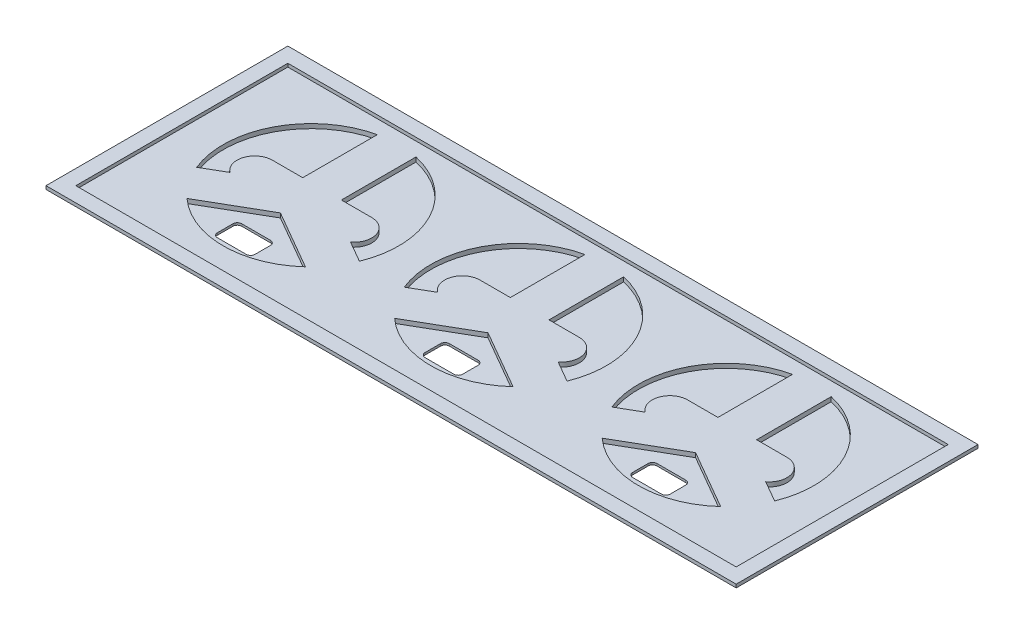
SolidWorks part; units mm, degrees
ref_plane "Front Plane" through (0, 0, 0) normal (0, 0, 1) x (1, 0, 0)
ref_plane "Top Plane" through (0, 0, 0) normal (0, 1, 0) x (1, 0, 0)
ref_plane "Right Plane" through (0, 0, 0) normal (1, 0, 0) x (0, 0, -1)
sketch "Sketch1" plane through (0, 0, 0) normal (0, 1, 0) x (1, 0, 0)
  line L1 (-151.5, 50) -> (151.5, 50)
  line L2 (-151.5, 50) -> (-151.5, -50)
  line L3 (-151.5, -50) -> (151.5, -50)
  line L4 (151.5, 50) -> (151.5, -50)
  line L5 (-151.5, 50) -> (151.5, -50) construction
  line L6 (-151.5, -50) -> (151.5, 50) construction
  point P0 (0, 0)
  dimension "D1" = 100
  dimension "D2" = 303
extrude "Boss-Extrude1" add sketch "Sketch1" along normal blind 3
sketch "Sketch2" plane through (0, 3, 0) normal (0, 1, 0) x (1, 0, 0)
  line L13 (-151.5, -50) -> (151.5, -50) construction
  line L14 (151.5, -50) -> (151.5, 50) construction
  line L15 (-151.5, 50) -> (-151.5, -50) construction
  line L16 (151.5, 50) -> (-151.5, 50) construction
  line L17 (-149.5, 48) -> (-149.5, -48)
  line L18 (-149.5, -48) -> (149.5, -48)
  line L19 (149.5, 48) -> (-149.5, 48)
  line L20 (149.5, -48) -> (149.5, 48)
  line L21 (-149.5, 48) -> (-149.5, -48)
  line L22 (-149.5, -48) -> (149.5, -48)
  line L23 (149.5, 48) -> (-149.5, 48)
  line L24 (149.5, -48) -> (149.5, 48)
  line L25 (-151.5, -50) -> (151.5, -50)
  line L26 (151.5, -50) -> (151.5, 50)
  line L27 (-151.5, 50) -> (-151.5, -50)
  line L28 (151.5, 50) -> (-151.5, 50)
  dimension "D1" = 2
extrude "Boss-Extrude3" add sketch "Sketch2" along normal blind 1.5 contours L24 L22 L21 L23 M12 M9 M10 M11
sketch "Sketch3" plane through (151.5, 0, 0) normal (1, 0, 0) x (0, 0, -1)
  line L0 (50, 4.5) -> (50, 0) construction
  line L1 (-50, 4.5) -> (50, 4.5)
  line L2 (-50, 4.5) -> (-50, 3)
  line L3 (-50, 3) -> (50, 3)
  line L4 (50, 4.5) -> (50, 3)
  dimension "D1" = 1.5
extrude "Boss-Extrude4" add sketch "Sketch3" along normal blind 4.75
sketch "Sketch5" plane through (0, 3, 0) normal (0, 1, 0) x (1, 0, 0)
  line L0 (149.5, -48) -> (149.5, 48) construction
  line L1 (0, 3) -> (0, 65.2785) construction
  line L2 (26.8157, -26.3425) -> (0, -10.8605)
  line L3 (-8.75, 41.775) -> (-8.75, 4.295)
  line L4 (8.75, 41.775) -> (8.75, 4.295)
  line L5 (36.8421, -11.924) -> (8.75, 4.295)
  line L6 (-36.8421, -11.924) -> (-8.75, 4.295)
  line L7 (-26.8157, -26.3425) -> (0, -10.8605)
  line L9 (-47, 60.0397) -> (-47, -70.5831) construction
  line L10 (5.6339, -4.0096) -> (33.9368, -20.3502) construction
  line L11 (-6.1109, -4.285) -> (-42.2034, -25.1229) construction
  line L12 (102.75, 41.775) -> (102.75, 4.295)
  line L13 (85.25, 41.775) -> (85.25, 4.295)
  line L14 (57.1579, -11.924) -> (85.25, 4.295)
  line L15 (67.1843, -26.3425) -> (94, -10.8605)
  line L16 (47, 76.7498) -> (47, -70.5831) construction
  line L17 (120.8157, -26.3425) -> (94, -10.8605)
  line L18 (130.8421, -11.924) -> (102.75, 4.295)
  line L19 (-67.1843, -26.3425) -> (-94, -10.8605)
  line L20 (-120.8157, -26.3425) -> (-94, -10.8605)
  line L21 (-130.8421, -11.924) -> (-102.75, 4.295)
  line L22 (-102.75, 41.775) -> (-102.75, 4.295)
  line L23 (-85.25, 41.775) -> (-85.25, 4.295)
  line L24 (-57.1579, -11.924) -> (-85.25, 4.295)
  line L26 (149.5, 48) -> (-149.5, 48) construction
  circle A3 centre (0, 3) radius 39.75
  arc A6 (26.8157, -26.3425) -> (-26.8157, -26.3425) centre (0, 3) cw
  arc A7 (36.8421, -11.924) -> (8.75, 41.775) centre (0, 3) ccw
  arc A8 (-8.75, 41.775) -> (-36.8421, -11.924) centre (0, 3) ccw
  circle A9 centre (94, 3) radius 39.75
  circle A10 centre (-94, 3) radius 39.75
  point P47 (0, 0)
  point P48 (0, 0)
  point P49 (0, 0)
  dimension "D1" = 79.5
  dimension "D2" = 37.48
  dimension "D3" = 17.5
  dimension "D4" = 17.5
  dimension "D9" = 14.5
  dimension "D10" = 14.5
  dimension "D11" = 5.25
  dimension "D5" = 17.5
  dimension "D6" = 120
  dimension "D7" = 8.75
  dimension "D8" = 8.75
  dimension "D12" = 3
extrude "Cut-Extrude2" cut sketch "Sketch5" against normal blind 2 contours A10 L23 L24 | A10 L21 L22 | A10 L19 L20 | L3 A3 L6 | L7 A3 L2 | L5 A3 L4 | A9 L12 L18 | A9 L17 L15 | A9 L14 L13
sketch "Sketch6" plane through (0, 1, 0) normal (0, 1, 0) x (1, 0, 0)
  line L1 (-6.5, -21.8605) -> (6.5, -21.8605)
  line L2 (-8.5, -23.8605) -> (-8.5, -30.8605)
  line L3 (-6.5, -32.8605) -> (6.5, -32.8605)
  line L4 (8.5, -23.8605) -> (8.5, -30.8605)
  line L5 (-8.5, -21.8605) -> (8.5, -32.8605) construction
  line L6 (-8.5, -32.8605) -> (8.5, -21.8605) construction
  line L7 (-100.5, -21.8605) -> (-87.5, -21.8605)
  line L8 (-102.5, -23.8605) -> (-102.5, -30.8605)
  line L9 (-100.5, -32.8605) -> (-87.5, -32.8605)
  line L10 (-85.5, -23.8605) -> (-85.5, -30.8605)
  line L11 (-102.5, -21.8605) -> (-85.5, -32.8605) construction
  line L12 (-102.5, -32.8605) -> (-85.5, -21.8605) construction
  line L13 (87.5, -21.8605) -> (100.5, -21.8605)
  line L14 (85.5, -23.8605) -> (85.5, -30.8605)
  line L15 (87.5, -32.8605) -> (100.5, -32.8605)
  line L16 (102.5, -23.8605) -> (102.5, -30.8605)
  line L17 (85.5, -21.8605) -> (102.5, -32.8605) construction
  line L18 (85.5, -32.8605) -> (102.5, -21.8605) construction
  arc A0 (-6.5, -21.8605) -> (-8.5, -23.8605) centre (-6.5, -23.8605) ccw
  arc A1 (-8.5, -30.8605) -> (-6.5, -32.8605) centre (-6.5, -30.8605) ccw
  arc A2 (6.5, -32.8605) -> (8.5, -30.8605) centre (6.5, -30.8605) ccw
  arc A3 (6.5, -21.8605) -> (8.5, -23.8605) centre (6.5, -23.8605) cw
  arc A5 (-87.5, -32.8605) -> (-85.5, -30.8605) centre (-87.5, -30.8605) ccw
  arc A6 (-102.5, -30.8605) -> (-100.5, -32.8605) centre (-100.5, -30.8605) ccw
  arc A7 (-100.5, -21.8605) -> (-102.5, -23.8605) centre (-100.5, -23.8605) ccw
  arc A8 (-87.5, -21.8605) -> (-85.5, -23.8605) centre (-87.5, -23.8605) cw
  arc A9 (85.5, -30.8605) -> (87.5, -32.8605) centre (87.5, -30.8605) ccw
  arc A10 (100.5, -32.8605) -> (102.5, -30.8605) centre (100.5, -30.8605) ccw
  arc A11 (100.5, -21.8605) -> (102.5, -23.8605) centre (100.5, -23.8605) cw
  arc A12 (87.5, -21.8605) -> (85.5, -23.8605) centre (87.5, -23.8605) ccw
  point P0 (0, -27.3605)
  point P5 (-94, -27.3605)
  point P23 (0, 0)
  point P39 (94, -27.3605)
  dimension "D4" = 2
  dimension "D5" = 11
  dimension "D8" = 2
  dimension "D12" = 2
  dimension "D1" = 11
  dimension "D2" = 11
  dimension "D3" = 17
  dimension "D6" = 17
  dimension "D7" = 11
  dimension "D9" = 11
  dimension "D10" = 11
  dimension "D11" = 17
extrude "Cut-Extrude3" cut sketch "Sketch6" against normal through all both and the other way through all
mirror "Mirror1" about plane through (0, 0, 0) normal (1, 0, 0) of "Boss-Extrude4"
sketch "Sketch7" plane through (0, 0, 50) normal (0, 0, 1) x (1, 0, 0)
  line L1 (156.25, 4.5) -> (-156.25, 4.5)
  line L2 (156.25, 4.5) -> (156.25, 3)
  line L3 (156.25, 3) -> (-156.25, 3)
  line L4 (-156.25, 4.5) -> (-156.25, 3)
extrude "Boss-Extrude5" add sketch "Sketch7" along normal blind 4.75
mirror "Mirror2" about plane through (0, 0, 0) normal (0, 0, 1) of "Boss-Extrude5"
sketch "Sketch8" plane through (0, 3, 0) normal (0, 1, 0) x (1, 0, 0)
  line L0 (-22.5, 0) -> (22.5, 0) construction
  line L1 (-22.5, 8) -> (22.5, 8)
  line L2 (-22.5, -8) -> (22.5, -8)
  line L3 (47, 67.8149) -> (47, -81.6541) construction
  line L4 (-47, 71.8097) -> (-47, -81.6541) construction
  line L5 (116.5, 0) -> (71.5, 0) construction
  line L6 (116.5, 8) -> (71.5, 8)
  line L7 (116.5, -8) -> (71.5, -8)
  line L8 (-71.5, 0) -> (-116.5, 0) construction
  line L9 (-71.5, 8) -> (-116.5, 8)
  line L10 (-71.5, -8) -> (-116.5, -8)
  arc A0 (-22.5, 8) -> (-22.5, -8) centre (-22.5, 0) ccw
  arc A1 (22.5, -8) -> (22.5, 8) centre (22.5, 0) ccw
  arc A13 (116.5, 8) -> (116.5, -8) centre (116.5, 0) cw
  arc A14 (71.5, -8) -> (71.5, 8) centre (71.5, 0) cw
  arc A15 (-71.5, 8) -> (-71.5, -8) centre (-71.5, 0) cw
  arc A16 (-116.5, -8) -> (-116.5, 8) centre (-116.5, 0) cw
  point P2 (0, 0)
  point P15 (-94, 0)
  point P27 (94, 0)
  dimension "D2" = 8
  dimension "D1" = 45
  dimension "D3" = 94
  dimension "D4" = 47
extrude "Boss-Extrude6" add sketch "Sketch8" against normal up to surface (2 mm away)
